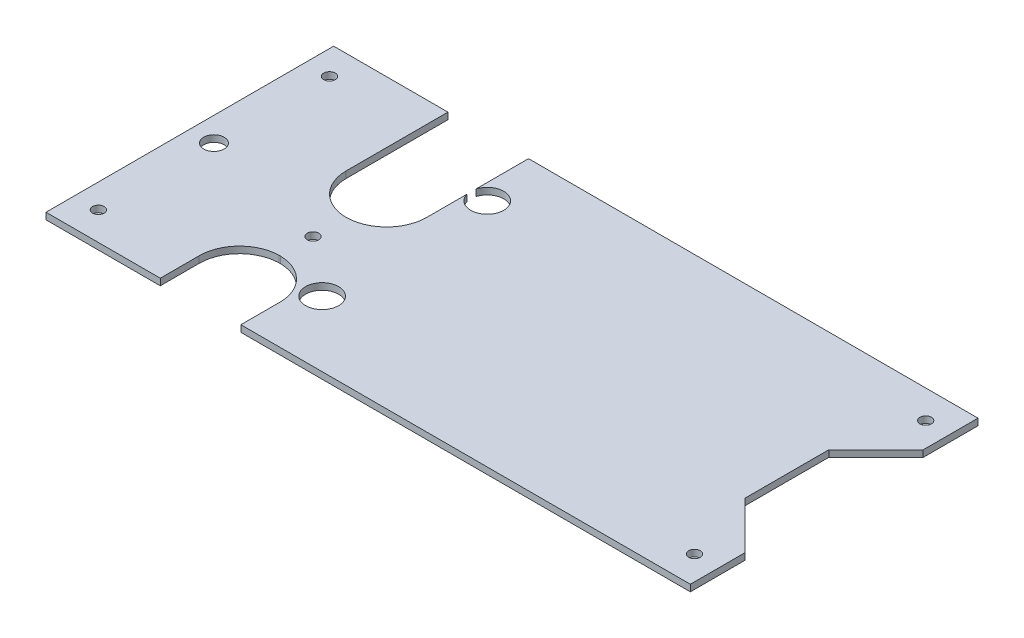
SolidWorks part; units mm, degrees
ref_plane "Plan de face" through (0, 0, 0) normal (0, 0, 1) x (1, 0, 0)
ref_plane "Plan de dessus" through (0, 0, 0) normal (0, 1, 0) x (1, 0, 0)
ref_plane "Plan de droite" through (0, 0, 0) normal (1, 0, 0) x (0, 0, -1)
sketch "Esquisse1" plane through (0, 0, 0) normal (0, 1, 0) x (1, 0, 0)
  line L0 (-89.4176, 41.7971) -> (-89.4176, -45.7029) construction
  line L1 (-89.4176, 41.7971) -> (-54.4176, 41.7971) construction
  line L2 (-89.4176, -45.7029) -> (-54.4176, -45.7029) construction
  line L3 (-54.4176, -33.7029) -> (-54.4176, -45.7029) construction
  line L4 (-30.4176, 10.7971) -> (-30.4176, 41.7971) construction
  line L5 (-30.4176, -45.7029) -> (-30.4176, -33.7029) construction
  line L6 (-30.4176, -45.7029) -> (106.0824, -45.7029) construction
  line L7 (106.0824, -45.7029) -> (106.0824, -28.8343) construction
  line L8 (91.7824, -14.5343) -> (106.0824, -28.8343) construction
  line L9 (91.7824, 10.6285) -> (91.7824, -14.5343) construction
  line L10 (106.0824, 24.9285) -> (91.7824, 10.6285) construction
  line L11 (106.0824, 24.9285) -> (106.0824, 41.7971) construction
  line L12 (-30.4176, 41.7971) -> (106.0824, 41.7971) construction
  line L13 (-54.4176, 41.7971) -> (-54.4176, 10.7971) construction
  line L14 (-54.6176, -33.7029) -> (-54.6176, -45.5029)
  line L15 (-81.9176, 33.0471) -> (98.5824, 33.0471) construction
  line L16 (-81.9176, 33.0471) -> (-81.9176, -36.9529) construction
  line L17 (-81.9176, -36.9529) -> (98.5824, -36.9529) construction
  line L18 (98.5824, 33.0471) -> (98.5824, -36.9529) construction
  line L19 (-89.2176, -45.5029) -> (-54.6176, -45.5029)
  line L20 (-89.2176, 41.5971) -> (-89.2176, -45.5029)
  line L21 (-89.2176, 41.5971) -> (-54.6176, 41.5971)
  line L22 (-54.6176, 41.5971) -> (-54.6176, 10.7971)
  line L23 (-30.2176, 10.7971) -> (-30.2176, 22.897)
  line L24 (-30.2176, 41.5971) -> (105.8824, 41.5971)
  line L25 (105.8824, 25.0113) -> (105.8824, 41.5971)
  line L26 (105.8824, 25.0113) -> (91.5824, 10.7113)
  line L27 (91.5824, 10.7113) -> (91.5824, -14.6171)
  line L28 (91.5824, -14.6171) -> (105.8824, -28.9171)
  line L29 (105.8824, -45.5029) -> (105.8824, -28.9171)
  line L30 (-30.2176, -45.5029) -> (105.8824, -45.5029)
  line L31 (-30.2176, -45.5029) -> (-30.2176, -33.7029)
  line L32 (-42.669, -21.5055) -> (-42.1662, -21.5055)
  line L33 (-42.6718, -1.4003) -> (-42.1634, -1.4003)
  line L34 (-89.4176, 41.7971) -> (-89.4176, -45.7029) construction
  line L35 (-89.4176, 41.7971) -> (-54.4176, 41.7971) construction
  line L36 (-89.4176, -45.7029) -> (-54.4176, -45.7029) construction
  line L37 (-54.4176, -33.7029) -> (-54.4176, -45.7029) construction
  line L38 (-30.4176, 10.7971) -> (-30.4176, 41.7971) construction
  line L39 (-30.4176, -45.7029) -> (-30.4176, -33.7029) construction
  line L40 (-30.4176, -45.7029) -> (106.0824, -45.7029) construction
  line L41 (106.0824, -45.7029) -> (106.0824, -28.8343) construction
  line L42 (91.7824, -14.5343) -> (106.0824, -28.8343) construction
  line L43 (91.7824, 10.6285) -> (91.7824, -14.5343) construction
  line L44 (106.0824, 24.9285) -> (91.7824, 10.6285) construction
  line L45 (106.0824, 24.9285) -> (106.0824, 41.7971) construction
  line L46 (-30.4176, 41.7971) -> (106.0824, 41.7971) construction
  line L47 (-54.4176, 41.7971) -> (-54.4176, 10.7971) construction
  line L48 (-20.4176, 29.2971) -> (-30.4176, 29.2971) construction
  line L49 (-20.4176, 19.2971) -> (-20.4176, 29.2971) construction
  line L50 (-30.4176, 19.2971) -> (-20.4176, 19.2971) construction
  line L51 (-30.4176, -30.7029) -> (-20.4176, -30.7029) construction
  line L52 (-30.4176, -20.7029) -> (-30.4176, -30.7029) construction
  line L53 (-20.4176, -20.7029) -> (-30.4176, -20.7029) construction
  line L54 (-20.4176, -30.7029) -> (-20.4176, -20.7029) construction
  line L55 (-30.4176, 29.2971) -> (-30.4176, 19.2971) construction
  line L56 (-25.4176, -20.7029) -> (-25.4176, -30.7029) construction
  line L57 (-25.4176, 29.2971) -> (-25.4176, 19.2971) construction
  line L58 (-30.2176, 25.6972) -> (-30.2176, 41.5971)
  line L60 (-30.2176, 10.7971) -> (-30.2176, 41.5971) construction
  arc A0 (-42.6649, -21.7055) -> (-54.4176, -33.7029) centre (-42.4176, -33.7029) ccw construction
  arc A1 (-30.4176, -33.7029) -> (-42.1703, -21.7055) centre (-42.4176, -33.7029) ccw construction
  arc A2 (-42.1676, -1.2003) -> (-30.4176, 10.7971) centre (-42.4176, 10.7971) ccw construction
  arc A3 (-54.4176, 10.7971) -> (-42.6676, -1.2003) centre (-42.4176, 10.7971) ccw construction
  circle A4 centre (-81.9176, 33.0471) radius 1.75
  circle A5 centre (-81.9176, -36.9529) radius 1.75
  circle A6 centre (-81.9176, -1.9529) radius 3.1
  circle A7 centre (-42.4176, -11.4529) radius 1.75
  circle A8 centre (98.5824, -36.9529) radius 1.75
  circle A9 centre (98.5824, 33.0471) radius 1.75
  arc A10 (-42.669, -21.5055) -> (-54.6176, -33.7029) centre (-42.4176, -33.7029) ccw
  arc A11 (-54.6176, 10.7971) -> (-42.6718, -1.4003) centre (-42.4176, 10.7971) ccw
  arc A12 (-42.1634, -1.4003) -> (-30.2176, 10.7971) centre (-42.4176, 10.7971) ccw
  arc A13 (-30.2176, -33.7029) -> (-42.1662, -21.5055) centre (-42.4176, -33.7029) ccw
  arc A14 (-42.6649, -21.7054) -> (-54.4176, -33.7029) centre (-42.4176, -33.7029) ccw construction
  arc A15 (-30.4176, -33.7029) -> (-42.1704, -21.7054) centre (-42.4176, -33.7029) ccw construction
  arc A16 (-42.1676, -1.2003) -> (-30.4176, 10.7971) centre (-42.4176, 10.7971) ccw construction
  arc A17 (-54.4176, 10.7971) -> (-42.6676, -1.2003) centre (-42.4176, 10.7971) ccw construction
  circle A18 centre (-81.9176, 33.0471) radius 1.475 construction
  circle A19 centre (-81.9176, -36.9529) radius 1.475 construction
  circle A20 centre (-81.9176, -1.9529) radius 3 construction
  circle A21 centre (-42.4176, -11.4529) radius 1.475 construction
  circle A22 centre (98.5824, -36.9529) radius 1.475 construction
  circle A23 centre (98.5824, 33.0471) radius 1.475 construction
  circle A25 centre (-25.4176, -25.7029) radius 5
  arc A26 (-30.2176, 22.897) -> (-30.2176, 25.6972) centre (-25.4176, 24.2971) ccw
extrude "Boss.-Extru.1" add sketch "Esquisse1" along normal blind 2
equation "\"D2@Esquisse1\"=\"D1@Esquisse1\""
equation "\"D4@Esquisse1\"=\"D1@Esquisse1\""
equation "\"D5@Esquisse1\"=\"D1@Esquisse1\""
equation "\"D3@Esquisse1\"=\"D1@Esquisse1\""
